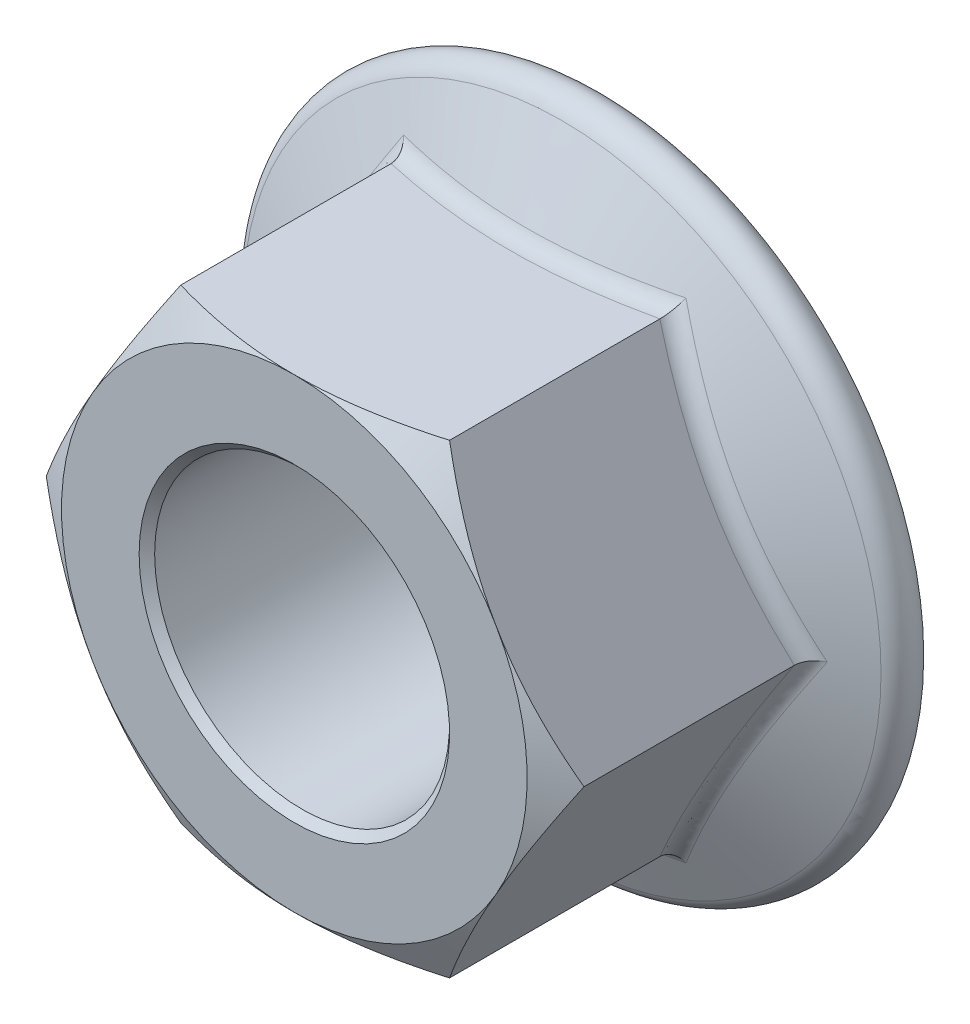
SolidWorks part; units mm, degrees
ref_plane "Front" through (0, 0, 0) normal (0, 0, 1) x (1, 0, 0)
ref_plane "Top" through (0, 0, 0) normal (0, 1, 0) x (1, 0, 0)
ref_plane "Right" through (0, 0, 0) normal (1, 0, 0) x (0, 0, -1)
other "Configuration Table"
sketch "Sketch1" plane through (0, 0, 0) normal (0, 0, 1) x (1, 0, 0)
  line L1 (8.6603, -15) -> (17.3205, 0)
  line L2 (17.3205, 0) -> (8.6603, 15)
  line L3 (8.6603, 15) -> (-8.6603, 15)
  line L4 (-8.6603, 15) -> (-17.3205, 0)
  line L5 (-17.3205, 0) -> (-8.6603, -15)
  line L6 (-8.6603, -15) -> (8.6603, -15)
  circle A0 centre (0, 0) radius 15 construction
  circle A1 centre (0, 0) radius 9.5
extrude "BaseNut" add sketch "Sketch1" against normal blind 20
sketch "Sketch3" plane through (0.6779, 0, -16.6426) normal (0, 1, 0) x (0, 0, -1)
  line L0 (4.0352, 0.6779) -> (-19.0613, 0.6779) construction
  line L2 (-16.6426, 15.6779) -> (-15.3029, 17.9984)
  line L4 (-15.3029, 17.9984) -> (-16.6426, 17.9984)
  line L5 (-16.6426, 17.9984) -> (-16.6426, 15.6779)
  line L6 (-6.6426, 17.9984) -> (-6.6426, 14.238) construction
  line L8 (3.3574, 17.9984) -> (3.3574, 15.6779)
  line L9 (2.0176, 17.9984) -> (3.3574, 17.9984)
  line L10 (3.3574, 15.6779) -> (2.0176, 17.9984)
  line L11 (3.3574, 17.9984) -> (-16.6426, 17.9984) construction
revolve "Double-Chamfer" cut sketch "Sketch3" angle 360 about L0
sketch "Sketch4" plane through (4.6827, 0, -16.7173) normal (0, 1, 0) x (0, 0, -1)
  line L0 (-21.7744, 4.6827) -> (9.7398, 4.6827) construction
  line L1 (-4.6401, 31.5206) -> (-4.6401, 11.2522) construction
  line L2 (3.2827, 14.1827) -> (3.2827, 24.6327)
  line L3 (0.5185, 25.2455) -> (-4.6401, 14.1827)
  line L4 (3.2827, 14.1827) -> (-16.7173, 14.1827) construction
  line L11 (-4.6401, 14.1827) -> (3.2827, 14.1827)
  arc A0 (3.2827, 24.6327) -> (0.5185, 25.2455) centre (1.8327, 24.6327) ccw
revolve "Flange" add sketch "Sketch4" angle 360 about L0
fillet "FlangeFillet" radius 1.2 6 edges at (15.0051, -4.0104, -14.8899) (-10.9757, -10.9896, -14.8899) (10.9757, 10.9896, -14.8899) (-15.0051, 4.0104, -14.8899)
sketch "Sketch5" plane through (-5.1971, 0, -15.1971) normal (0, 1, 0) x (0, 0, -1)
  line L0 (3.5984, -5.1971) -> (-23.9926, -5.1971) construction
  line L2 (-15.1971, 4.8029) -> (-15.1971, 4.3029)
  line L4 (-15.1971, 4.3029) -> (-14.6971, 4.3029)
  line L6 (-14.6971, 4.3029) -> (-15.1971, 4.8029)
  line L7 (-5.1971, 4.3029) -> (-5.1971, 0.8242) construction
  line L8 (4.3029, 4.3029) -> (4.8029, 4.8029)
  line L9 (4.8029, 4.3029) -> (4.3029, 4.3029)
  line L10 (4.8029, 4.8029) -> (4.8029, 4.3029)
  line L15 (4.8029, 4.3029) -> (-15.1971, 4.3029) construction
  dimension "da" = 20
  dimension "D2" = 45
revolve "Hole" cut sketch "Sketch5" angle 360 about L0
sketch "Sketch6" plane through (0, 0, 0) normal (0, 1, 0) x (1, 0, 0)
  line L0 (-9.933, 0.5) -> (-9.5, 0.25)
  line L1 (-9.5, 0.25) -> (-9, 0.25)
  line L2 (-9, 0.25) -> (-9, 0.75)
  line L3 (-9, 0.75) -> (-9.5, 0.75)
  line L4 (-9.5, 0.75) -> (-9.933, 0.5)
  line L5 (0, 5.2426) -> (0, 47.481) construction
revolve "Cut-Revolve10" [suppressed] cut sketch "Sketch6" angle 360 about L5
pattern_linear "LPattern10" [suppressed] count 31 spacing 0.6 along (0, 0, -1)
equation "\"m1@Sketch4\" = \"m@BaseNut\""
equation "\"sq@Sketch3\" = \"s@Sketch1\""
equation "\"D2@Sketch6\"=\"D1@Sketch1\""
equation "\"D1@Sketch6\"= ( \"D2@ThreadCosmetic1\" - \"D2@Sketch6\" )  / 2"
equation "\"D3@LPattern10\" = \"D1@Sketch6\" * 1.2"
equation "\"D1@LPattern10\" = \"m@BaseNut\" / \"D3@LPattern10\"-2"
